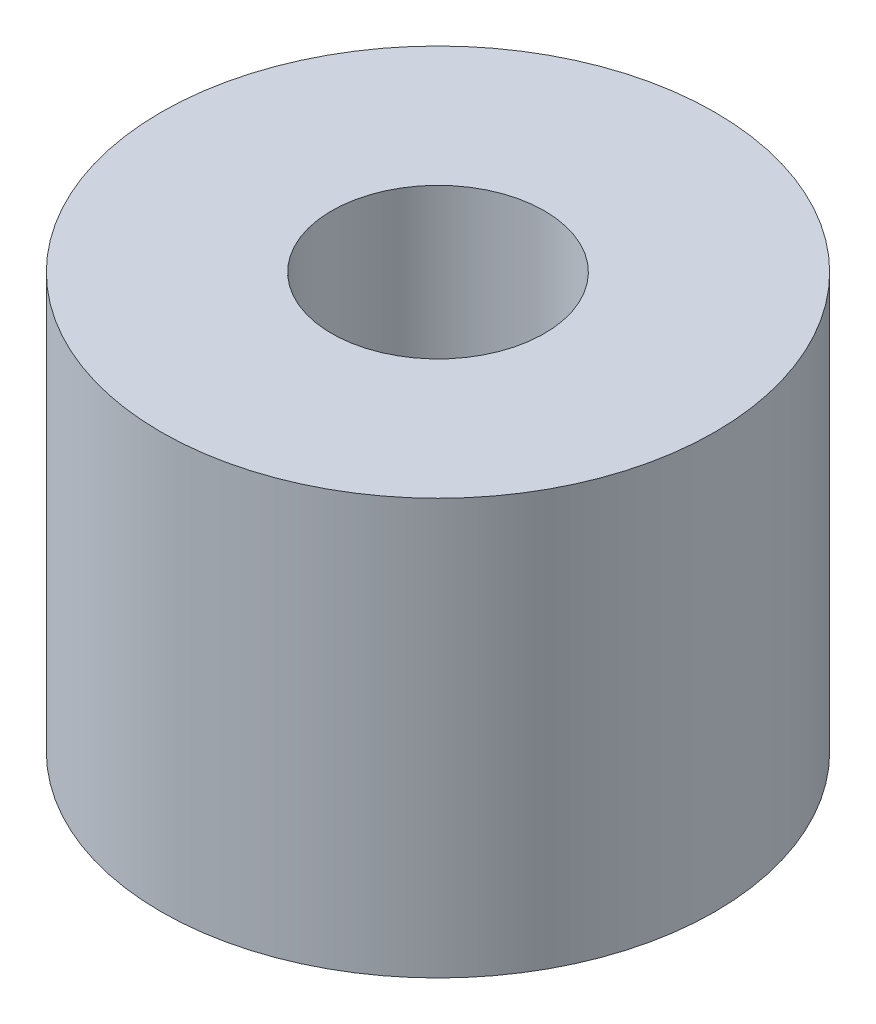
SolidWorks part; units mm, degrees
ref_plane "Front" through (0, 0, 0) normal (0, 0, 1) x (1, 0, 0)
ref_plane "Top" through (0, 0, 0) normal (0, 1, 0) x (1, 0, 0)
ref_plane "Right" through (0, 0, 0) normal (1, 0, 0) x (0, 0, -1)
sketch "Sketch1" plane through (0, 0, 0) normal (0, 1, 0) x (1, 0, 0)
  circle A0 centre (0, 0) radius 6.35
  circle A1 centre (0, 0) radius 2.4384
  dimension "D1" = 4.8768
  dimension "D2" = 12.7
extrude "Boss-Extrude1" add sketch "Sketch1" along normal blind 9.525
